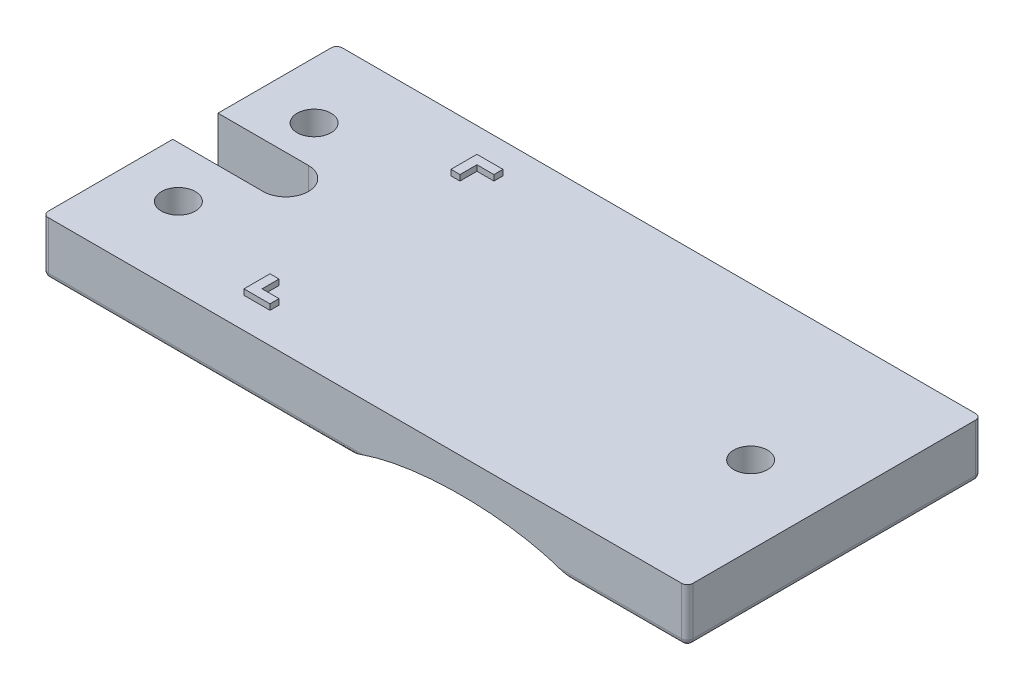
SolidWorks part; units mm, degrees
ref_plane "Front Plane" through (0, 0, 0) normal (0, 0, 1) x (1, 0, 0)
ref_plane "Top Plane" through (0, 0, 0) normal (0, 1, 0) x (1, 0, 0)
ref_plane "Right Plane" through (0, 0, 0) normal (1, 0, 0) x (0, 0, -1)
sketch "Sketch1" plane through (0, 0, 0) normal (0, 1, 0) x (1, 0, 0)
  line L1 (-43.7317, 5.792) -> (13.2683, 5.792)
  line L2 (-43.7317, 5.792) -> (-43.7317, -20.208)
  line L3 (-43.7317, -20.208) -> (13.2683, -20.208)
  line L4 (13.2683, 5.792) -> (13.2683, -20.208)
  dimension "D1" = 57
  dimension "D2" = 26
extrude "Boss-Extrude1" add sketch "Sketch1" along normal blind 4.75
sketch "Sketch6" plane through (0, 0, -5.792) normal (0, 0, -1) x (-1, 0, 0)
  line L2 (43.7317, 4.75) -> (-13.2683, 4.75) construction
  line L4 (43.7317, 4.75) -> (43.7317, 0) construction
  line L5 (19.2317, -2.75) -> (-5.7683, -2.75)
  ellipse E0 centre (6.7317, -2.75) end of major axis (19.2317, -2.75) minor radius 4.5 (19.2317, -2.75) -> (-5.7683, -2.75) ccw
  dimension "D2" = 37
  dimension "D1" = 7.5
  dimension "D3" = 25
  dimension "D4" = 9
extrude "Cut-Extrude4" cut sketch "Sketch6" against normal through all
sketch "Sketch8" plane through (0, 4.75, 0) normal (0, 1, 0) x (1, 0, 0)
  line L2 (-35.7317, -8.708) -> (-45.7317, -8.708)
  line L3 (13.2683, -20.208) -> (13.2683, 5.792) construction
  line L4 (-35.7317, -4.708) -> (-45.7317, -4.708)
  line L5 (-45.7317, -8.708) -> (-45.7317, -4.708)
  line L6 (13.2683, 5.792) -> (-43.7317, 5.792) construction
  arc A0 (-35.7317, -8.708) -> (-35.7317, -4.708) centre (-35.7317, -6.708) ccw
  dimension "D2" = 2
  dimension "D1" = 12.5
  dimension "D3" = 10
  dimension "D5" = 59
extrude "Cut-Extrude6" cut sketch "Sketch8" against normal through all
fillet "Fillet3" radius 0.5 13 edges at (13.2683, 0, 7.208) (13.2683, 2.375, 20.208) (8.2155, 0, 20.208) (-30.1788, 0, 20.208) (13.2683, 2.375, -5.792) (8.2155, 0, -5.792) (-30.1788, 0, -5.792) (-43.7317, 2.375, 20.208) (-43.7317, 0, 14.458) (-43.7317, 0, -0.542) (-43.7317, 2.375, -5.792) (-16.626, 0, 7.208) (3.1626, 0, 7.208)
hole_wizard "CSK for M3 Countersunk Flat Head Screw1" positions "Sketch10" profile "Sketch9" countersink size "M3" standard "ISO"
sketch "Sketch10" plane through (0, 0, 0) normal (0, -1, 0) x (-1, 0, 0)
  line L0 (43.2317, -20.208) -> (15.3774, -20.208) construction
  line L1 (43.7317, -8.708) -> (43.7317, -19.708) construction
  line L2 (43.7317, 5.292) -> (43.7317, -4.708) construction
  line L3 (-1.9141, -20.208) -> (-12.7683, -20.208) construction
  line L4 (-13.2683, -19.708) -> (-13.2683, 5.292) construction
  point P0 (38.7317, -13.208)
  point P2 (38.7317, -1.208)
  point P4 (-6.3683, -7.708)
  dimension "D1" = 7
  dimension "D2" = 5
  dimension "D3" = 12
  dimension "D4" = 5
  dimension "D5" = 12.5
  dimension "D6" = 6.9
sketch "Sketch9" plane through (-38.7317, 0, 13.208) normal (1, 0, 0) x (0, 0, -1)
  line L0 (0, 0) -> (0, 4.75)
  line L1 (0, 4.75) -> (1.5, 4.75)
  line L2 (1.5, 4.75) -> (1.5, 1.35)
  line L3 (1.5, 1.35) -> (2.85, 0)
  line L5 (2.85, 0) -> (0, 0)
  line L6 (-1.5, 1.35) -> (-2.85, 0) construction
  line L11 (0, -6.35) -> (0, 107.95) construction
  dimension "Thru Hole Dia." = 3
  dimension "Thru Hole Depth" = 4.75
  dimension "Near C'Sink Dia." = 5.7
  dimension "Near C'Sink Angle" = 90
sketch "Sketch11" plane through (0, 4.75, 0) normal (0, 1, 0) x (1, 0, 0)
  line L0 (13.2683, -7.208) -> (-48.1659, -7.208) construction
  line L1 (13.2683, -19.708) -> (13.2683, 5.292) construction
  line L2 (-28.6317, 0.792) -> (-27.8317, 0.792)
  line L3 (-28.6317, 3.092) -> (-26.3317, 3.092)
  line L4 (-28.6317, 3.092) -> (-28.6317, 0.792)
  line L5 (-27.8317, 0.792) -> (-27.8317, 2.292)
  line L6 (-27.8317, 2.292) -> (-26.3317, 2.292)
  line L7 (-26.3317, 2.292) -> (-26.3317, 3.092)
  line L8 (12.7683, 5.792) -> (-43.2317, 5.792) construction
  line L9 (-43.7317, 5.292) -> (-43.7317, -4.708) construction
  line L10 (-28.6317, -17.508) -> (-28.6317, -15.208)
  line L11 (-28.6317, -15.208) -> (-27.8317, -15.208)
  line L12 (-27.8317, -15.208) -> (-27.8317, -16.708)
  line L13 (-26.3317, -16.708) -> (-26.3317, -17.508)
  line L14 (-27.8317, -16.708) -> (-26.3317, -16.708)
  line L15 (-28.6317, -17.508) -> (-26.3317, -17.508)
  dimension "D1" = 2.3
  dimension "D2" = 0.8
  dimension "D3" = 0.8
  dimension "D4" = 2.7
  dimension "D5" = 15.1
extrude "Boss-Extrude2" add sketch "Sketch11" along normal blind 0.5
sketch "Sketch12" plane through (0, 0, 0) normal (0, -1, 0) x (1, 0, 0)
  line L0 (13.2683, 7.208) -> (-44.0851, 7.208) construction
  line L1 (13.2683, 19.708) -> (13.2683, -5.292) construction
  line L2 (-43.7317, 8.708) -> (-43.7317, 19.708) construction
  line L3 (-33.2317, -2.242) -> (-19.2317, -2.242)
  line L4 (-33.2317, -2.242) -> (-33.2317, 16.758)
  line L5 (-33.2317, 16.758) -> (-19.2317, 16.758)
  line L6 (-19.2317, -2.242) -> (-19.2317, 16.758)
  line L7 (-43.2317, 20.208) -> (-15.3774, 20.208) construction
  dimension "D1" = 19
  dimension "D2" = 14
  dimension "D3" = 10.5
  dimension "D4" = 3.45
extrude "Cut-Extrude7" cut sketch "Sketch12" against normal blind 1
